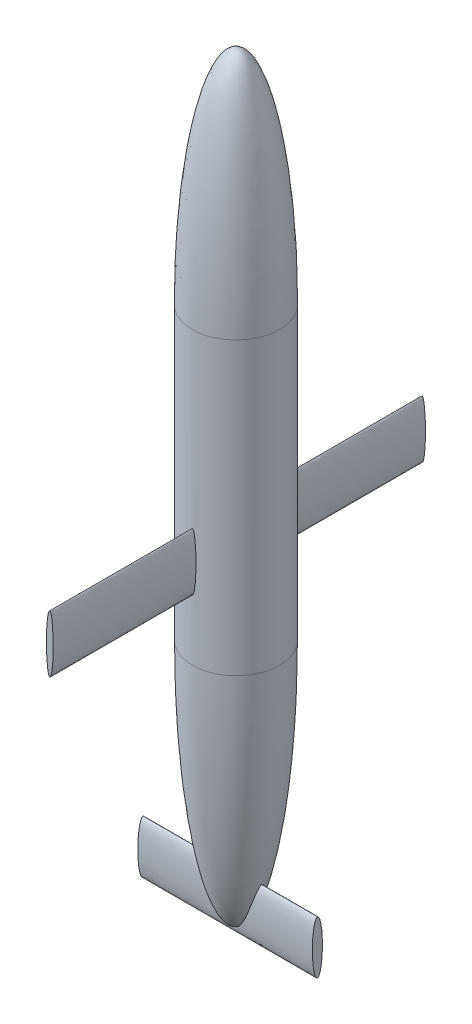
SolidWorks part; units mm, degrees
ref_plane "Front Plane" through (0, 0, 0) normal (0, 0, 1) x (1, 0, 0)
ref_plane "Top Plane" through (0, 0, 0) normal (0, 1, 0) x (1, 0, 0)
ref_plane "Right Plane" through (0, 0, 0) normal (1, 0, 0) x (0, 0, -1)
sketch "Sketch1" plane through (0, 0, 0) normal (0, 0, 1) x (1, 0, 0)
  line L0 (0, 0) -> (150, 0)
  line L1 (0.1027, 762) -> (0, 0)
  ellipse E0 centre (0, 0) end of major axis (0.1027, 762) minor radius 150 (0.1027, 762) -> (150, 0) cw
  point P2 (0.6138, 529.3504)
  dimension "D1" = 150
  dimension "D2" = 762
revolve "Revolve1" add sketch "Sketch1" angle 360 about L1
sketch "Sketch2" plane through (0, 0, 0) normal (0, 1, 0) x (1, 0, 0)
  circle A0 centre (0, 0) radius 149.408
extrude "Boss-Extrude1" add sketch "Sketch2" against normal blind 1000 separate body
ref_plane "Plane1" through (0, -500, 0) normal (0, -1, 0) x (-1, 0, 0)
sketch "Sketch3" plane through (0, 0, 0) normal (0, 0, 1) x (1, 0, 0)
  line L0 (-149.408, -1000) -> (149.408, -1000) construction
  line L1 (0, -1846.4747) -> (0, -1000)
  line L2 (0, -1000) -> (149.408, -1000)
  ellipse E0 centre (0, -1000) end of major axis (0, -153.5253) minor radius 149.408 (0, -1846.4747) -> (149.408, -1000) ccw
revolve "Revolve2" add sketch "Sketch3" angle 360 about L1
ref_plane "Plane2" through (0, 0, 140) normal (0, 0, 1) x (1, 0, 0)
sketch "Sketch4" plane through (0, 0, 140) normal (0, 0, 1) x (1, 0, 0)
  ellipse E0 centre (0, -691.2363) end of major axis (0, -592.8837) minor radius 11.6934
extrude "Boss-Extrude2" add sketch "Sketch4" along normal blind 500
ref_plane "Plane3" through (0, 0, -140) normal (0, 0, 1) x (1, 0, 0)
ref_plane "Plane4" through (0, 0, 0) normal (0, 0, 1) x (1, 0, 0)
mirror "Mirror2" about plane through (0, 0, 0) normal (0, 0, 1) of "Boss-Extrude2"
ref_plane "Plane5" through (280, 0, 0) normal (1, 0, 0) x (0, 0, -1)
sketch "Sketch5" plane through (280, 0, 0) normal (1, 0, 0) x (0, 0, -1)
  ellipse E0 centre (0, -1774.544) end of major axis (0, -1865.1639) minor radius 17.3256
extrude "Boss-Extrude3" add sketch "Sketch5" against normal blind 600
